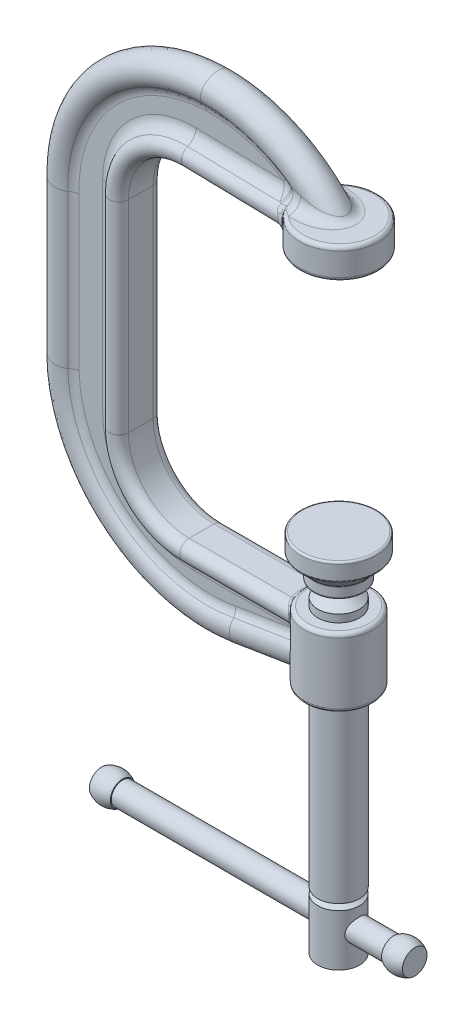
SolidWorks part; units mm, degrees
ref_plane "Front Plane" through (0, 0, 0) normal (0, 0, 1) x (1, 0, 0)
ref_plane "Top Plane" through (0, 0, 0) normal (0, 1, 0) x (1, 0, 0)
ref_plane "Right Plane" through (0, 0, 0) normal (1, 0, 0) x (0, 0, -1)
sketch "Sketch1" plane through (0, 0, 0) normal (0, 0, 1) x (1, 0, 0)
  line L0 (0, 102.3938) -> (-64.5175, 102.3938) construction
  line L1 (-133.35, 33.5613) -> (-133.35, -30.3863)
  line L2 (-53.5466, -98.3388) -> (0, -89.6937)
  line L3 (0, -89.6937) -> (0, -67.4687)
  line L4 (0, -67.4687) -> (-71.4375, -67.4688)
  line L5 (-96.8375, 42.0687) -> (-96.8375, -42.0688)
  line L6 (-70.8709, 67.4624) -> (0, 65.8813) construction
  line L7 (0, 65.8813) -> (0, 102.3938) construction
  line L8 (0, 0) -> (-96.8375, 0) construction
  line L9 (-70.8709, 67.4624) -> (-3.175, 65.9521)
  line L11 (-64.5175, -99.2187) -> (5.3328, -99.2187) construction
  arc A0 (-70.8709, 67.4624) -> (-96.8375, 42.0687) centre (-71.4375, 42.0687) ccw
  arc A1 (-96.8375, -42.0688) -> (-71.4375, -67.4688) centre (-71.4375, -42.0688) ccw
  arc A2 (-64.5175, 102.3938) -> (-133.35, 33.5613) centre (-64.5175, 33.5613) ccw
  arc A3 (-133.35, -30.3863) -> (-53.5466, -98.3388) centre (-64.5175, -30.3863) ccw
  arc A4 (-64.5175, 102.3938) -> (-3.175, 65.9521) centre (-64.5175, 32.5438) cw
  dimension "D2" = 133.35
  dimension "D3" = 96.8375
  dimension "D7" = 69.85
  dimension "D6" = 25.4
  dimension "D1" = 31.75
  dimension "D4" = 133.35
  dimension "D5" = 201.6125
  dimension "D9" = 99.2187
  dimension "D10" = 22.225
  dimension "D11" = 3.175
extrude "Extrude1" add sketch "Sketch1" along normal mid plane 6.35
sketch "Sketch2" plane through (0, 0, 0) normal (1, 0, 0) x (0, 0, -1)
  line L0 (-3.175, -67.4688) -> (3.175, -67.4688) construction
  line L1 (-9.1281, -67.4688) -> (9.1281, -67.4688) construction
  line L2 (-9.1281, -67.4688) -> (-9.1281, -75.4062) construction
  line L3 (-9.1281, -75.4062) -> (9.1281, -75.4062) construction
  line L4 (9.1281, -67.4688) -> (9.1281, -75.4062) construction
  line L5 (0, -98.3388) -> (0, -67.4688) construction
  line L6 (-3.175, -98.3388) -> (3.175, -98.3388) construction
  line L7 (-3.175, -89.6937) -> (-3.175, -67.4687) construction
  line L9 (3.175, -89.6937) -> (3.175, -67.4687) construction
  line L10 (-5.1594, -67.4688) -> (5.1594, -67.4688)
  line L11 (-3.175, -80.1688) -> (3.175, -80.1688)
  arc A0 (-5.1594, -67.4688) -> (-6.6092, -75.132) centre (-5.1594, -71.4375) ccw
  arc A1 (-6.6092, -75.132) -> (-3.175, -80.1688) centre (-8.5857, -80.1688) cw
  arc A2 (5.1594, -67.4688) -> (6.6092, -75.132) centre (5.1594, -71.4375) cw
  arc A3 (6.6092, -75.132) -> (3.175, -80.1688) centre (8.5857, -80.1688) ccw
  dimension "D4" = 5.4107
  dimension "D1" = 7.9375
  dimension "D2" = 18.2562
  dimension "D3" = 12.7
sketch "Sketch3" plane through (0, 0, 0) normal (0, 0, 1) x (1, 0, 0)
  line L0 (0, -67.4687) -> (-71.4375, -67.4688)
  line L1 (0, -67.4687) -> (-71.4375, -67.4688) construction
  line L2 (-70.8709, 67.4624) -> (-3.175, 65.9521)
  line L3 (-96.8375, -42.0688) -> (-96.8375, 42.0687)
  arc A0 (-96.8375, -42.0688) -> (-71.4375, -67.4688) centre (-71.4375, -42.0688) ccw construction
  arc A1 (-70.8709, 67.4624) -> (-96.8375, 42.0687) centre (-71.4375, 42.0687) ccw
  arc A2 (-96.8375, -42.0688) -> (-71.4375, -67.4688) centre (-71.4375, -42.0688) ccw
  arc A3 (-70.8709, 67.4624) -> (-96.8375, 42.0687) centre (-71.4375, 42.0687) ccw construction
sweep "Sweep1" add profiles "Sketch2" path "Sketch3"
sketch "Sketch4" plane through (0, 0, 0) normal (1, 0, 0) x (0, 0, -1)
  line L0 (0, -67.4688) -> (0, -83.3438) construction
  line L2 (-5.1594, -67.4688) -> (5.1594, -67.4688) construction
  line L3 (-3.175, -89.6937) -> (3.175, -89.6937) construction
  circle A0 centre (0, -83.3438) radius 6.35
  dimension "D1" = 12.7
sketch "Sketch5" plane through (0, 0, 0) normal (0, 0, 1) x (1, 0, 0)
  line L0 (-133.35, 33.5613) -> (-133.35, -30.3863)
  line L1 (0, -89.6937) -> (-53.5466, -98.3388)
  arc A0 (-64.5175, 102.3938) -> (-133.35, 33.5613) centre (-64.5175, 33.5613) ccw
  arc A1 (-133.35, -30.3863) -> (-53.5466, -98.3388) centre (-64.5175, -30.3863) ccw
  arc A2 (-4.6271, 68.4904) -> (-64.5175, 102.3938) centre (-64.5175, 32.5438) ccw
  arc A5 (-133.35, -30.3863) -> (-53.5466, -98.3388) centre (-64.5175, -30.3863) ccw construction
  arc A7 (-64.5175, 102.3938) -> (-133.35, 33.5613) centre (-64.5175, 33.5613) ccw construction
  arc A9 (-12.2291, 78.8572) -> (-64.5175, 102.3938) centre (-64.5175, 32.5438) ccw construction
sweep "Sweep2" add profiles "Sketch4" path "Sketch5"
sketch "Sketch6" plane through (0, 0, 0) normal (1, 0, 0) x (0, 0, -1)
  line L0 (-6.35, -83.3438) -> (-9.1281, -83.3438)
  line L2 (-9.1281, -83.3438) -> (-9.1281, -108.7438)
  line L3 (-9.1281, -42.0687) -> (-9.1281, -71.4375) construction
  line L5 (0, -83.3438) -> (0, -110.6061) construction
  line L6 (9.1281, -83.3438) -> (9.1281, -108.7438)
  line L7 (6.35, -83.3438) -> (9.1281, -83.3438)
  line L8 (-9.1281, -108.7438) -> (9.1281, -108.7438)
  arc A0 (-6.35, -83.3438) -> (6.35, -83.3438) centre (0, -83.3438) ccw
  arc A2 (-3.585, -78.1026) -> (-3.175, -88.843) centre (0, -83.3438) ccw construction
  dimension "D1" = 25.4
sketch "Sketch7" plane through (0, 0, 0) normal (0, 0, 1) x (1, 0, 0)
  line L0 (-133.35, 33.5613) -> (-133.35, -30.3863)
  line L2 (0, -89.6937) -> (-53.5466, -98.3388)
  arc A1 (-64.5175, 102.3938) -> (-133.35, 33.5613) centre (-64.5175, 33.5613) ccw
  arc A2 (-64.5175, 102.3938) -> (-133.35, 33.5613) centre (-64.5175, 33.5613) ccw construction
  arc A4 (-16.0027, -17.709) -> (-64.5175, 102.3938) centre (-64.5175, 32.5438) ccw
  arc A5 (-12.2291, 78.8572) -> (-64.5175, 102.3938) centre (-64.5175, 32.5438) ccw construction
  arc A6 (-133.35, -30.3863) -> (-53.5466, -98.3388) centre (-64.5175, -30.3863) ccw
sweep "Cut-Sweep1" cut profiles "Sketch6" path "Sketch7"
ref_plane "Plane1" through (0, -65.8812, 0) normal (0, 1, 0) x (-1, 0, 0)
ref_plane "Plane2" through (0, 62.7063, 0) normal (0, 1, 0) x (-1, 0, 0)
sketch "Sketch8" plane through (0, -65.8812, 0) normal (0, 1, 0) x (-1, 0, 0)
  line L4 (0, 0) -> (14.2875, 0) construction
  line L5 (-0.7938, 9.1281) -> (3.2961, 9.1281)
  line L7 (71.4375, 9.1281) -> (0, 9.1281) construction
  line L8 (-0.7937, -9.1281) -> (3.2961, -9.1281)
  line L11 (-0.7938, 9.1281) -> (-0.7937, -9.1281)
  line L12 (0, -9.1281) -> (71.4375, -9.1281) construction
  line L16 (0, 5.1594) -> (0, -5.1594) construction
  arc A0 (3.2961, 9.1281) -> (3.2961, -9.1281) centre (14.2875, 0) ccw
  dimension "D1" = 28.575
  dimension "D2" = 0.7937
extrude "Extrude2" cut sketch "Sketch8" against normal through all and the other way through all
sketch "Sketch9" plane through (0, -65.8812, 0) normal (0, 1, 0) x (-1, 0, 0)
  circle A0 centre (14.2875, 0) radius 14.2875
  arc A1 (3.2961, 9.1281) -> (3.2961, -9.1281) centre (14.2875, 0) ccw construction
extrude "Extrude3" add sketch "Sketch9" against normal blind 28.702
sketch "Sketch10" plane through (0, 62.7063, 0) normal (0, 1, 0) x (-1, 0, 0)
  line L0 (14.2875, 16.2719) -> (-9.4346, 16.2719) construction
  line L1 (0, 0) -> (14.2875, 0) construction
  line L2 (30.9563, 0) -> (30.9563, 24.3604) construction
  circle A1 centre (14.2875, 0) radius 14.2875 construction
  ellipse E0 centre (14.2875, 0) end of major axis (-2.3812, 0) minor radius 16.2719
  dimension "D1" = 32.5437
  dimension "D2" = 33.3375
extrude "Extrude4" add sketch "Sketch10" along normal blind 12.7
sketch "Sketch11" plane through (0, -65.8812, 0) normal (0, 1, 0) x (-1, 0, 0)
  circle A0 centre (14.2875, 0) radius 9.525
  dimension "D1" = 19.05
extrude "Extrude5" cut sketch "Sketch11" against normal up to next
fillet "Fillet1" radius 1.5875 4 edges at (-28.575, -94.5832, 0) (-28.575, -65.8812, 0) (2.3812, 62.7063, 0) (2.3812, 75.4063, 0)
fillet "Fillet2" radius 4.7625 23 edges at (-106.2533, 72.6262, 3.175) (-106.2533, 72.6262, -3.175) (-121.6522, -0.3011, 3.175) (-121.6522, -0.3011, -3.175) (-100.1206, -75.1116, 3.175) (-100.1206, -75.1116, -3.175) (-47.1442, 88.0723, -3.175) (-47.1442, 88.0723, 3.175) (-40.8822, -84.4449, -3.175) (-28.2178, -81.2845, -3.175) (-40.8822, -84.4449, 3.175) (-28.2178, -81.2845, 3.175) (-27.1788, -86.1906, 6.1601) (-28.0487, -77.5662, -3.842) (-29.0293, 78.6715, -3.2041) (-9.3813, 75.4063, 0.4092) (-26.0478, 75.4063, -4.6933) (-26.0478, 75.4063, 4.6933) (0.7937, 75.4063, 0) (-29.4385, 75.0892, -5.115) (-29.3726, 75.1495, 5.0425)
fillet "Fillet3" radius 4.7625 11 edges at (-14.1574, 75.4063, 5.8667) (-29.2313, 75.0812, 5.6937) (-28.3158, 68.8762, 8.7886) (-30.9558, 66.5719, -0.1134) (-28.1361, 69.7259, -9.0561) (-29.3613, 74.9365, -5.812) (-12.4151, 75.4063, -5.107) (0.7937, 75.4063, 0)
fillet "Fillet4" radius 1.5875 10 edges at (-27.6303, -76.0227, 5.1092) (-25.3356, -70.7022, 9.0594) (-28.575, -67.4688, 0) (-28.5237, -71.8275, -1.2098) (-28.0487, -77.5662, -3.842) (-28.0897, -82.2429, -3.6922) (-27.1349, -88.841, -6.2511) (-28.5742, -94.3051, -0.1554) (-27.0908, -88.0573, 6.3409) (-28.1959, -81.019, 3.2693)
sketch "Sketch12" plane through (0, 0, 0) normal (0, 0, 1) x (1, 0, 0)
  line L0 (-14.2875, -65.8812) -> (-14.2875, 108.3763) construction
  line L1 (-4.7625, -65.8812) -> (-23.8125, -65.8812) construction
  line L2 (-30.1625, -38.8937) -> (-14.2875, -38.8937)
  line L3 (-30.1625, -38.8937) -> (-30.1625, -46.0375)
  line L4 (-30.1625, -46.0375) -> (-24.6062, -51.5937)
  line L5 (-24.6062, -51.5937) -> (-24.6062, -56.3562)
  line L6 (-24.6062, -56.3562) -> (-22.225, -56.3562)
  line L7 (-14.2875, 43.6563) -> (-14.2875, -38.8937) construction
  line L8 (-29.3688, 62.7063) -> (0.7937, 62.7063) construction
  line L9 (-22.225, -56.3562) -> (-22.225, -53.6437)
  line L10 (-14.2875, -38.8937) -> (-14.2875, -41.275)
  line L11 (-18.2563, -56.8803) -> (-18.2562, -59.5312)
  line L12 (-23.0187, -62.7062) -> (-18.2562, -59.5312)
  line L13 (-23.0187, -62.7062) -> (-23.0187, -191.2937)
  line L14 (-23.0187, -191.2937) -> (-14.2875, -191.2937)
  line L15 (-14.2875, -42.0687) -> (-14.2875, -191.2937)
  line L16 (-14.2875, -191.2937) -> (-13.8816, -190.2326)
  arc A0 (-14.2875, -41.275) -> (-22.225, -53.6437) centre (-14.2875, -50.0062) ccw
  arc A1 (-14.2875, -42.0687) -> (-18.2563, -56.8803) centre (-14.2875, -50.0062) ccw
  dimension "D8" = 8.7312
  dimension "D10" = 15.875
  dimension "D1" = 31.75
  dimension "D2" = 101.6
  dimension "D3" = 7.1437
  dimension "D4" = 17.4625
  dimension "D5" = 12.7
  dimension "D6" = 20.6375
  dimension "D7" = 15.875
  dimension "D9" = 6.35
  dimension "D11" = 20.6375
  dimension "D12" = 152.4
  dimension "D13" = 17.4625
  dimension "D14" = 7.9375
  dimension "D15" = 23.8125
revolve "Revolve1" add sketch "Sketch12" angle 360 about L0
sketch "Sketch13" plane through (0, 0, 0) normal (-1, 0, 0) x (0, 0, 1)
  line L0 (0, -191.2937) -> (0, -178.5938) construction
  line L1 (-8.7312, -191.2937) -> (8.7312, -191.2937) construction
  circle A0 centre (0, -178.5938) radius 5.5562
  dimension "D2" = 11.1125
  dimension "D1" = 12.7
extrude "Extrude6" cut sketch "Sketch13" along normal through all
sketch "Sketch14" plane through (0, 0, 0) normal (0, 0, 1) x (1, 0, 0)
  line L0 (-5.5563, -173.0375) -> (-5.5563, -62.7062) construction
  line L1 (13.0969, -172.2438) -> (22.1736, -172.2438) construction
  line L2 (17.4625, -173.4344) -> (8.7313, -173.4344) construction
  line L3 (8.7313, -173.4344) -> (8.7313, -173.8312)
  line L4 (17.4625, -178.5938) -> (17.4625, -173.4344)
  line L5 (-5.5563, -178.5938) -> (24.2544, -178.5938) construction
  line L6 (8.7313, -173.8312) -> (-104.3623, -173.8312)
  line L7 (-113.0935, -178.5938) -> (-113.0935, -173.4344)
  line L8 (-113.0935, -178.5938) -> (17.4625, -178.5938)
  line L9 (-14.2875, -191.2937) -> (-14.2875, -113.3238) construction
  line L10 (-23.0187, -191.2937) -> (-5.5563, -191.2937) construction
  line L11 (-47.8155, -178.5938) -> (-47.8155, -124.7485) construction
  line L12 (-113.0935, -173.4344) -> (-104.3623, -173.4344) construction
  line L13 (-108.7279, -172.2438) -> (-117.8046, -172.2438) construction
  line L14 (-104.3623, -173.4344) -> (-104.3623, -173.8312)
  line L15 (-5.5563, -173.0375) -> (-5.5563, -184.15) construction
  arc A0 (17.4625, -173.4344) -> (8.7313, -173.4344) centre (13.0969, -180.8427) ccw
  arc A1 (-113.0935, -173.4344) -> (-104.3623, -173.4344) centre (-108.7279, -180.8427) cw
  dimension "D1" = 130.556
  dimension "D2" = 9.525
  dimension "D3" = 12.7
  dimension "D4" = 0.3969
  dimension "D5" = 8.7312
  dimension "D6" = 31.75
revolve "Revolve2" add sketch "Sketch14" angle 360 about L8
chamfer "Chamfer1" distance 1.5875 angle 45 1 edges at (-14.2875, -191.2937, -8.7312)
chamfer "Chamfer2" distance 0.7937 angle 45 1 edges at (-14.2875, -56.3562, -7.9375)
fillet "Fillet5" radius 0.7937 4 edges at (-14.2875, -56.3562, -10.3187) (-14.2875, -51.5937, -10.3187) (-14.2875, -46.0375, -15.875) (-14.2875, -38.8937, -15.875)
sketch "Sketch15" plane through (0, 0, 0) normal (0, 0, 1) x (1, 0, 0)
  line L0 (-23.0187, -169.815) -> (-20.819, -168.545)
  line L1 (-23.0187, -62.7062) -> (-23.0187, -173.0375) construction
  line L2 (-20.819, -168.545) -> (-23.0187, -167.275)
  line L3 (-23.0187, -62.7062) -> (-23.0187, -173.0375) construction
  line L4 (-23.0187, -167.275) -> (-23.0187, -169.815)
  line L5 (-20.819, -168.545) -> (-23.0187, -168.545) construction
  dimension "D1" = 2.54
  dimension "D2" = 60
revolve "Cut-Revolve1" cut sketch "Sketch15" angle 360 about axis through (-14.2875, -65.8812, 0) along (0, -1, 0)
pattern_linear "LPattern1" [suppressed] count 42 spacing 2.794
sketch "Sketch18" plane through (0, -191.2937, 0) normal (0, -1, 0) x (1, 0, 0)
  circle A0 centre (-14.2875, 0) radius 8.7312
extrude "Boss-Extrude3" add sketch "Sketch18" against normal blind 20.32
sketch "Sketch19" plane through (0, -94.5832, 0) normal (0, -1, 0) x (1, 0, 0)
  circle A0 centre (-14.2875, 0) radius 11.3225
extrude "Boss-Extrude4" add sketch "Sketch19" against normal up to surface (28.702 mm away)
sketch "Sketch20" plane through (0, -38.8937, 0) normal (0, 1, 0) x (1, 0, 0)
  circle A0 centre (-14.2875, 0) radius 10.7342
extrude "Boss-Extrude5" add sketch "Sketch20" against normal blind 9.398
